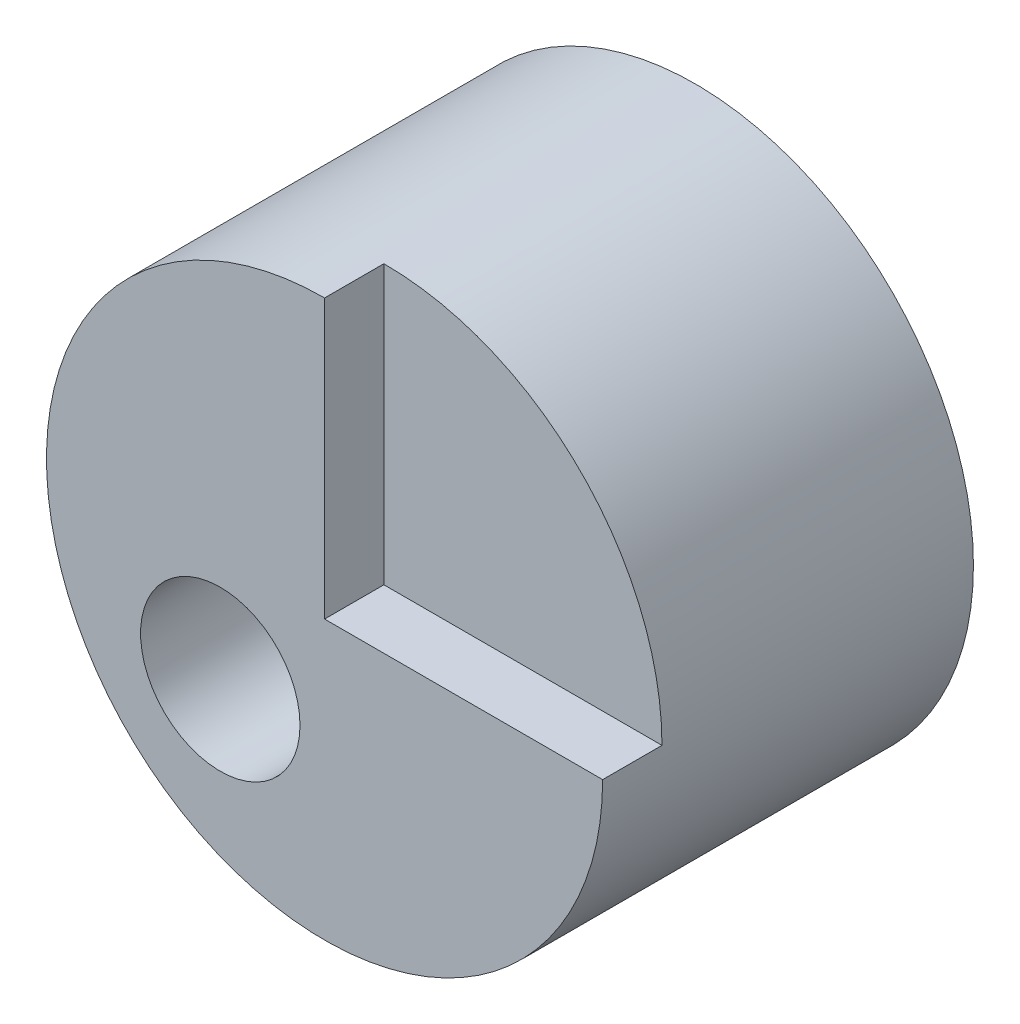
SolidWorks part; units mm, degrees
ref_plane "Plan de face" through (0, 0, 0) normal (0, 0, 1) x (1, 0, 0)
ref_plane "Plan de dessus" through (0, 0, 0) normal (0, 1, 0) x (1, 0, 0)
ref_plane "Plan de droite" through (0, 0, 0) normal (1, 0, 0) x (0, 0, -1)
sketch "Esquisse1" plane through (0, 0, 0) normal (0, 0, 1) x (1, 0, 0)
  line L0 (-10.639, 6.6314) -> (-10.639, -0.8686) construction
  line L1 (-10.639, -0.8686) -> (-10.639, 14.1314) construction
  circle A0 centre (-10.639, 6.6314) radius 7.5
  dimension "D1" = 15
extrude "Boss.-Extru.1" add sketch "Esquisse1" along normal blind 10
sketch "Esquisse3" plane through (0, 0, 10) normal (0, 0, 1) x (1, 0, 0)
  line L0 (-10.639, 14.1314) -> (-10.639, -0.8686) construction
  line L6 (-18.139, 6.6314) -> (-3.139, 6.6314) construction
  line L9 (-1.9469, 16.1057) -> (-10.639, 16.1057)
  line L10 (-1.9469, 16.1057) -> (-1.9469, 6.6314)
  line L11 (-1.9469, 6.6314) -> (-10.639, 6.6314)
  line L12 (-10.639, 16.1057) -> (-10.639, 6.6314)
  circle A0 centre (-10.639, 6.6314) radius 7.5 construction
  point P10 (-1.9469, 13.6577)
extrude "Enlèv. mat.-Extru.3" cut sketch "Esquisse3" against normal blind 1.6 contours L9 L12 L11 L10
sketch "Esquisse5" plane through (0, 0, 10) normal (0, 0, 1) x (1, 0, 0)
  line L0 (-10.639, 6.6314) -> (-18.139, 6.6314) construction
  line L1 (-18.139, 6.6314) -> (-10.639, -0.8686) construction
  line L2 (-10.639, -0.8686) -> (-10.639, 6.6314) construction
  line L3 (-10.639, 6.6314) -> (-14.389, 2.8814) construction
  line L4 (-14.389, 2.8814) -> (-12.514, 4.7564) construction
  line L5 (-12.514, 4.7564) -> (-18.139, 6.6314) construction
  line L6 (-18.139, 6.6314) -> (-12.514, 4.7564) construction
  line L7 (-12.514, 4.7564) -> (-10.639, -0.8686) construction
  line L8 (-12.514, 4.7564) -> (-14.389, 2.8814)
  line L9 (-16.264, 1.0064) -> (-12.514, 4.7564)
  arc A0 (-10.639, 14.1314) -> (-3.139, 6.6314) centre (-10.639, 6.6314) ccw construction
  circle A1 centre (-13.4515, 3.8189) radius 2.15
  point P14 (-14.389, 2.8814)
  dimension "D1" = 4.3
extrude "Enlèv. mat.-Extru.4" cut sketch "Esquisse5" against normal through all contours A1
